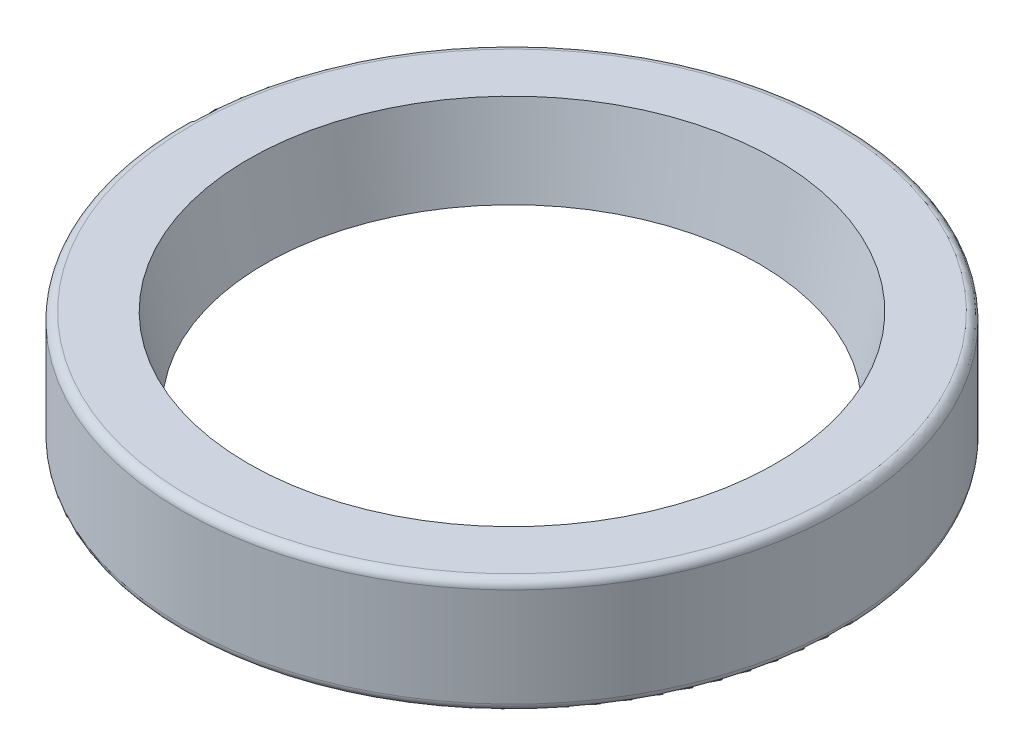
SolidWorks part; units mm, degrees
ref_plane "Plan1" through (0, 0, 0) normal (0, 0, 1) x (1, 0, 0)
ref_plane "Plan2" through (0, 0, 0) normal (0, 1, 0) x (1, 0, 0)
ref_plane "Plan3" through (0, 0, 0) normal (1, 0, 0) x (0, 0, -1)
sketch "Esquisse1" plane through (0, 0, 0) normal (0, 0, 1) x (1, 0, 0)
  line L0 (0, 17.8504) -> (0, -11.6084) construction
  line L1 (0, -50) -> (0, 50) construction
  line L2 (50, 0) -> (-50, 0) construction
  line L3 (16, 7) -> (20, 7)
  line L5 (18.5, 0) -> (20, 0)
  line L6 (20, 7) -> (20, 0)
  line L7 (16, 7) -> (15, 2)
  line L8 (15, 2) -> (16.6441, 1)
  line L9 (16.6441, 1) -> (17.5, 1)
  line L10 (17.5, 1) -> (17.5, 5.5)
  line L11 (17.5, 5.5) -> (18.5, 5.5)
  line L12 (18.5, 5.5) -> (18.5, 0)
  dimension "D1" = 30
  dimension "D2" = 40
  dimension "D3" = 7
  dimension "D4" = 1
  dimension "D5" = 5
  dimension "D6" = 110
  dimension "D7" = 1
  dimension "D8" = 1.5
  dimension "D9" = 2.5
  dimension "D10" = 1.5
revolve "Révolution1" add sketch "Esquisse1" angle 360 about L0
fillet "Congé1" radius 0.5 2 edges at (0, 0, 20) (0, 7, 20)
